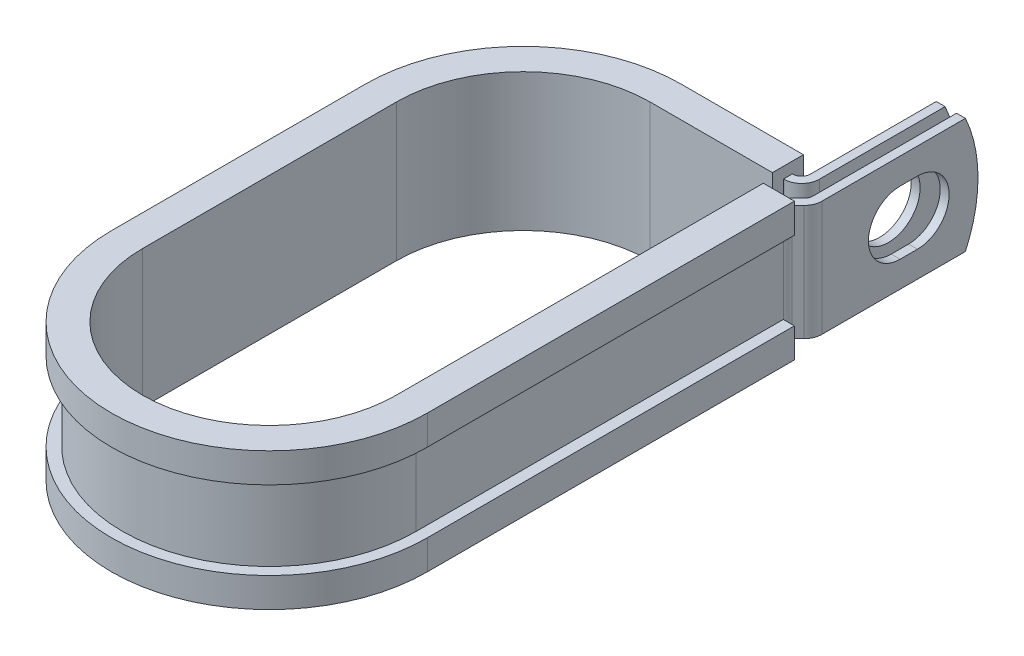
SolidWorks part; units mm, degrees
ref_plane "Front Plane" through (0, 0, 0) normal (0, 0, 1) x (1, 0, 0)
ref_plane "Top Plane" through (0, 0, 0) normal (0, 1, 0) x (1, 0, 0)
ref_plane "Right Plane" through (0, 0, 0) normal (1, 0, 0) x (0, 0, -1)
sketch "Sketch1" plane through (0, 0, 0) normal (0, 1, 0) x (1, 0, 0)
  line L0 (0, 18.9865) -> (16.8708, 18.9865)
  line L1 (18.9865, 0) -> (18.9865, 15.574)
  line L2 (19.3092, 40.4622) -> (19.3092, 21.4249)
  line L3 (19.7007, 17.2982) -> (20.5269, 18.1244)
  line L4 (-18.9865, 0) -> (-18.9865, -34.925)
  line L5 (20.884, 18.9865) -> (20.884, 40.4622)
  line L6 (18.9865, 0) -> (18.9865, -34.925)
  arc A0 (0, 18.9865) -> (-18.9865, 0) centre (0, 0) ccw
  arc A1 (19.7007, 17.2982) -> (18.9865, 15.574) centre (21.4249, 15.574) ccw
  arc A2 (20.5269, 18.1244) -> (20.884, 18.9865) centre (19.6648, 18.9865) ccw
  arc A3 (16.8708, 18.9865) -> (19.3092, 21.4249) centre (16.8708, 21.4249) ccw
  arc A4 (-18.9865, -34.925) -> (18.9865, -34.925) centre (0, -34.925) ccw
extrude "Extrude-Thin1" add sketch "Sketch1" along normal mid plane 15.875 thin
sketch "Sketch2" plane through (18.09, 0, 0) normal (-1, 0, 0) x (0, 0, 1)
  line L0 (-40.4622, 7.9375) -> (-40.4622, -7.9375) construction
  line L1 (0, 7.9375) -> (0, -7.9375) construction
  circle A0 centre (-30.9372, 0) radius 4.3561
  point P2 (-40.4622, 0)
extrude "Cut-Extrude1" cut sketch "Sketch2" against normal up to surface (1.2192 mm away)
sketch "Sketch3" plane through (22.1032, 0, 0) normal (1, 0, 0) x (0, 0, -1)
  line L0 (29.7434, 0) -> (32.131, 0) construction
  line L1 (29.7434, 4.3561) -> (32.131, 4.3561)
  line L2 (29.7434, -4.3561) -> (32.131, -4.3561)
  line L3 (40.4622, 7.9375) -> (40.4622, -7.9375) construction
  arc A0 (29.7434, 4.3561) -> (29.7434, -4.3561) centre (29.7434, 0) ccw
  arc A1 (32.131, -4.3561) -> (32.131, 4.3561) centre (32.131, 0) ccw
  point P3 (30.9372, 0)
  point P8 (40.4622, 0)
  point P11 (25.3873, 0)
  point P12 (36.4871, 0)
extrude "Cut-Extrude2" cut sketch "Sketch3" against normal up to surface (1.2192 mm away)
sketch "Sketch4" plane through (18.09, 0, 0) normal (-1, 0, 0) x (0, 0, 1)
  line L0 (-40.4622, 7.9375) -> (-40.4622, -7.9375)
  line L1 (-40.4622, 7.9375) -> (-38.7298, 7.9375)
  line L2 (-40.4622, 7.9375) -> (-21.4249, 7.9375) construction
  line L3 (-40.4622, -7.9375) -> (-38.7298, -7.9375)
  line L4 (-40.4622, -7.9375) -> (-21.4249, -7.9375) construction
  arc A0 (-38.7298, 7.9375) -> (-38.7298, -7.9375) centre (-21.4122, 0) ccw
extrude "Cut-Extrude3" cut sketch "Sketch4" against normal through all contours A0 M4 M5 | A0 L0 M2
ref_plane "Plane1" through (0, 0, -15.574) normal (0, 0, -1) x (-1, 0, 0)
ref_plane "Plane2" through (16.82, 0, 0) normal (-1, 0, 0) x (0, 0, 1)
sketch "Sketch5" plane through (0, 0, -15.574) normal (0, 0, -1) x (-1, 0, 0)
  line L0 (-20.2057, 7.9375) -> (-18.9865, 7.9375)
  line L1 (-20.2057, 7.9375) -> (-20.2057, -7.9375) construction
  line L3 (-18.9865, 7.9375) -> (-18.9865, -7.9375)
  line L4 (-18.9865, -7.9375) -> (-20.2057, -7.9375)
  line L5 (-20.2057, -7.9375) -> (-20.2057, -5.3975)
  line L6 (-20.2057, 7.9375) -> (-20.2057, 5.3975)
  line L7 (-21.7297, 9.4615) -> (-21.7297, 5.3975)
  line L8 (-21.7297, 9.4615) -> (-17.4625, 9.4615)
  line L9 (-17.4625, 9.4615) -> (-17.4625, -9.4615)
  line L10 (-17.4625, -9.4615) -> (-21.7297, -9.4615)
  line L11 (-21.7297, -9.4615) -> (-21.7297, -5.3975)
  line L12 (-21.7297, 5.3975) -> (-20.2057, 5.3975)
  line L13 (-20.2057, -5.3975) -> (-21.7297, -5.3975)
sketch "Sketch6" plane through (0, 7.9375, 0) normal (0, 1, 0) x (1, 0, 0)
  line L0 (17.4625, 0) -> (17.4625, 15.574)
  line L1 (17.4625, 15.574) -> (21.7297, 15.574) construction
  line L2 (16.82, 6.9878) -> (16.82, -6.9878) construction
  line L3 (17.4625, -34.925) -> (17.4625, 0)
  line L4 (-17.4625, -34.925) -> (-17.4625, 0)
  line L5 (0, 17.4625) -> (16.82, 17.4625)
  arc A0 (0, 17.4625) -> (-17.4625, 0) centre (0, 0) ccw
  arc A1 (-17.4625, -34.925) -> (17.4625, -34.925) centre (0, -34.925) ccw
sweep "Sweep1" add profiles "Sketch5" path "Sketch6"
equation "\"D4@Sketch5\" = \"D1@Extrude-Thin1\""
equation "\"D5@Sketch5\" = \"D5@Extrude-Thin1\""
equation "\"D1@Sketch3\" = \"D2@Sketch2\""
equation "\"D7@Sketch1\" = \"D3@Sketch2\" + \"D1@Sketch3\""
equation "\"D1@Sketch1\" = \"D1@Sketch6\" + 2 * \"D3@Sketch5\""
equation "\"D1@Sketch4\" = ( \"D1@Extrude-Thin1\" + .125 ) * 2"
equation "\"D9@Sketch1\"= \"D5@Extrude-Thin1\""
equation "\"D8@Sketch1\"= 2 * \"D5@Extrude-Thin1\""
equation "\"D2@Sketch1\" = 2 * \"D5@Extrude-Thin1\""
equation "\"D2@Sketch3\" = \"D1@Sketch2\""
equation "\"D6@Sketch1\" = \"D1@Sketch1\""
equation "\"D3@Sketch1\" = \"D1@Sketch6\""
